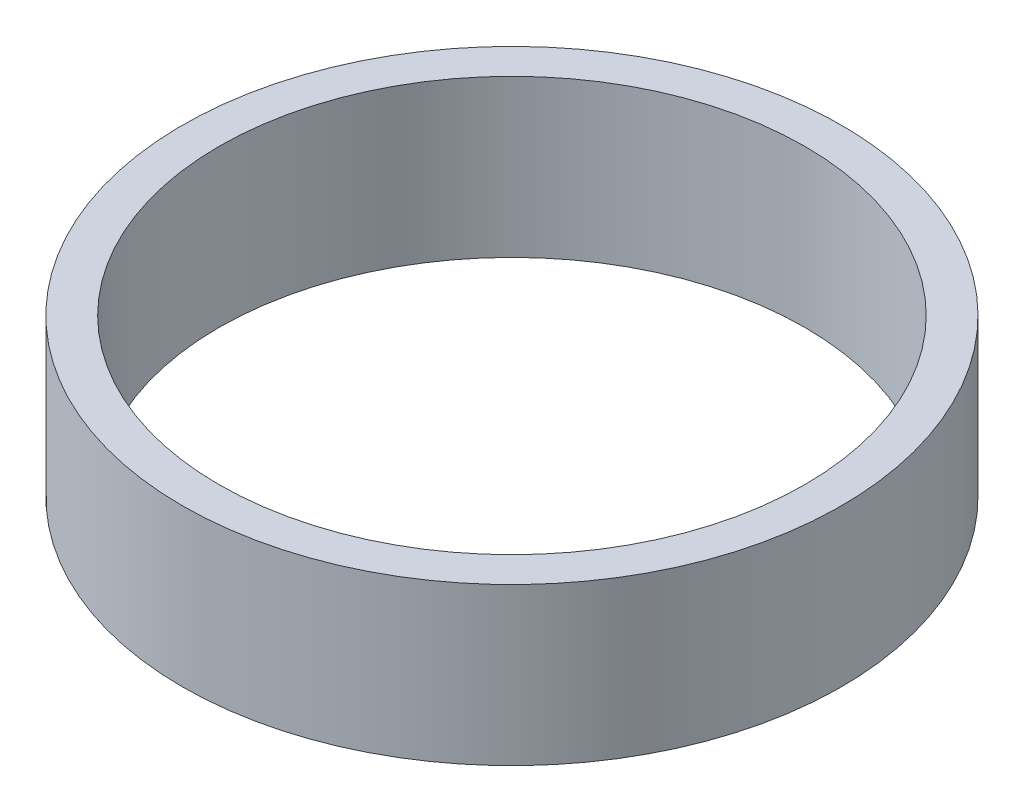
SolidWorks part; units mm, degrees
ref_plane "Front Plane" through (0, 0, 0) normal (0, 0, 1) x (1, 0, 0)
ref_plane "Top Plane" through (0, 0, 0) normal (0, 1, 0) x (1, 0, 0)
ref_plane "Right Plane" through (0, 0, 0) normal (1, 0, 0) x (0, 0, -1)
sketch "Sketch1" plane through (0, 0, 0) normal (0, 1, 0) x (1, 0, 0)
  circle A0 centre (0, 0) radius 16
  circle A1 centre (0, 0) radius 18
  dimension "D1" = 32
  dimension "D2" = 2
extrude "Boss-Extrude1" add sketch "Sketch1" along normal blind 8.5663
